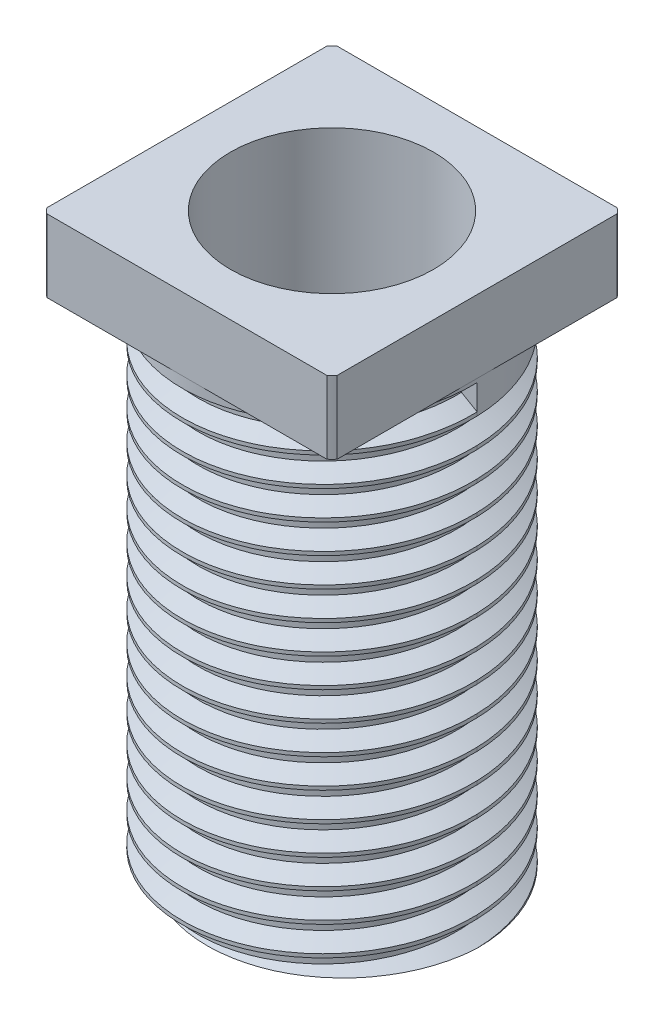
SolidWorks part; units mm, degrees
ref_plane "Płaszczyzna przednia" through (0, 0, 0) normal (0, 0, 1) x (1, 0, 0)
ref_plane "Płaszczyzna górna" through (0, 0, 0) normal (0, 1, 0) x (1, 0, 0)
ref_plane "Płaszczyzna prawa" through (0, 0, 0) normal (1, 0, 0) x (0, 0, -1)
sketch "Szkic1" plane through (0, 0, 0) normal (0, 1, 0) x (1, 0, 0)
  line L0 (-5.5, 3.5001) -> (-5.5, -3.5001)
  line L1 (-3.5001, -5.5) -> (3.5001, -5.5)
  line L2 (5.5, -3.5001) -> (5.5, 3.5001)
  line L3 (3.5001, 5.5) -> (-3.5001, 5.5)
  line L4 (5.5, 0) -> (-5.5, 0) construction
  circle A0 centre (0, 0) radius 3.5
  ellipse E0 centre (-3.4999, -3.4999) end of major axis (-4.9142, -4.9142) minor radius 2 (-5.5, -3.5001) -> (-3.5001, -5.5) ccw
  ellipse E1 centre (3.4999, -3.4999) end of major axis (2.0856, -2.0856) minor radius 2 (3.5001, -5.5) -> (5.5, -3.5001) ccw
  ellipse E2 centre (3.4999, 3.4999) end of major axis (4.9142, 4.9142) minor radius 2 (5.5, 3.5001) -> (3.5001, 5.5) ccw
  ellipse E3 centre (-3.4999, 3.4999) end of major axis (-4.9142, 4.9142) minor radius 2 (-3.5001, 5.5) -> (-5.5, 3.5001) ccw
extrude "Dodanie-wyciągnięcie1" add sketch "Szkic1" along normal blind 2.5
sketch "Szkic2" plane through (0, 2.5, 0) normal (0, 1, 0) x (1, 0, 0)
  line L1 (-5, -5) -> (5, -5)
  line L2 (-5, -5) -> (-5, 5)
  line L3 (-5, 5) -> (5, 5)
  line L4 (5, -5) -> (5, 5)
  line L5 (0, 5) -> (0, -5) construction
  line L6 (-5, 0) -> (5, 0) construction
  point P0 (0, 0)
  dimension "D1" = 10
  dimension "D2" = 10
extrude "Wytnij-wyciągnięcie1" cut sketch "Szkic2" against normal blind 2.5 flip side to cut
sketch "Szkic3" plane through (0, 0, 0) normal (0, -1, 0) x (1, 0, 0)
  circle A0 centre (0, 0) radius 3.5
  circle A1 centre (0, 0) radius 5
extrude "Dodanie-wyciągnięcie2" add sketch "Szkic3" along normal blind 17
thread "Gwint1" pitch 1 start angle 0, offset 1, length 17, pitch 1, diameter 10
ref_plane "Płaszczyzna1" through (5, -18, 0) normal (0, 0, 1) x (1, 0, 0)
sketch "Profil gwintu1" plane through (5, -18, 0) normal (0, 0, 1) x (1, 0, 0)
  line L0 (0, 0) -> (0, 1) construction
  line L11 (0, 0) -> (0, 0.875)
  line L12 (0, 0.875) -> (-0.5413, 0.5625)
  line L13 (-0.5413, 0.5625) -> (-0.5413, 0.3125)
  line L15 (-0.5413, 0.3125) -> (0, 0)
  line L17 (-0.5413, 0.4375) -> (0, 0.4375) construction
  point P2 (0, 0)
  dimension "Pitch" = 1
  dimension "Profile_Angle" = 60
  dimension "Profile_Land" = 0.25
  dimension "Profile_Height" = 0.5413
fillet "Zaokrąglenie1" radius 0.5 1 edges at (0, -17, -3.5)
